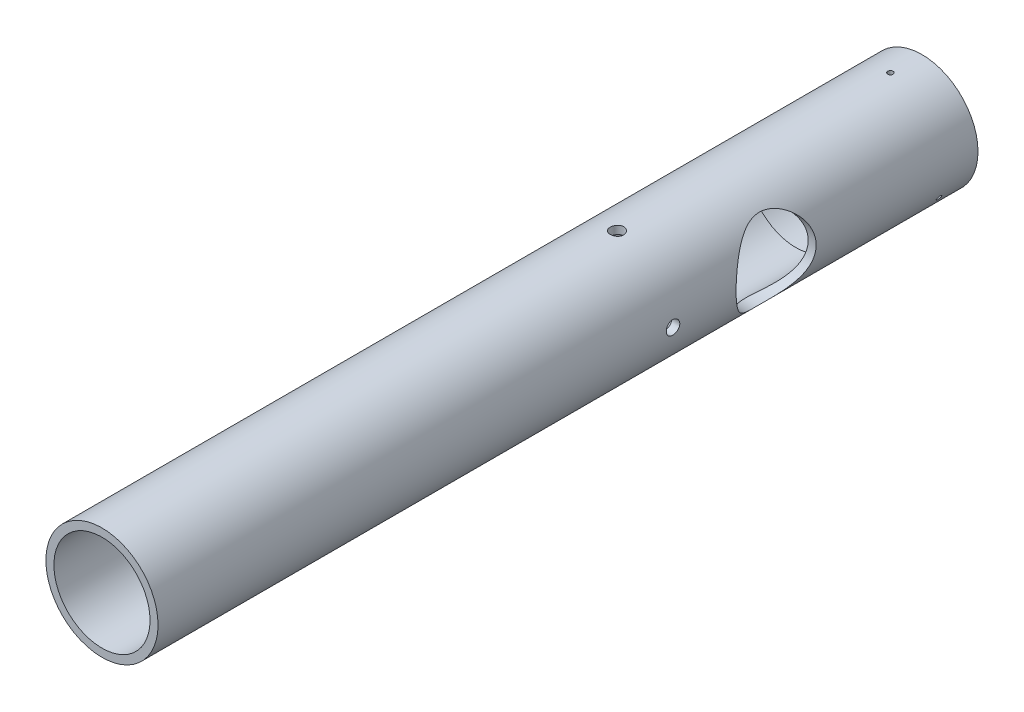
SolidWorks part; units mm, degrees
ref_plane "Front Plane" through (0, 0, 0) normal (0, 0, 1) x (1, 0, 0)
ref_plane "Top Plane" through (0, 0, 0) normal (0, 1, 0) x (1, 0, 0)
ref_plane "Right Plane" through (0, 0, 0) normal (1, 0, 0) x (0, 0, -1)
sketch "Sketch1" plane through (0, 0, 0) normal (0, 0, 1) x (1, 0, 0)
  circle A0 centre (0, 0) radius 44.45
  circle A1 centre (0, 0) radius 38.1
  dimension "D1" = 88.9
  dimension "D2" = 6.35
extrude "Boss-Extrude1" add sketch "Sketch1" along normal blind 500 and the other way blind 150
ref_plane "Plane1" through (0, 44.45, 0) normal (0, 1, 0) x (-1, 0, 0)
ref_plane "Plane2" through (0, 0, -50) normal (0, 0, 1) x (1, 0, 0)
sketch "Sketch6" plane through (0, 0, -50) normal (0, 0, 1) x (1, 0, 0)
  circle A0 centre (0, 0) radius 39.6508
  dimension "D1" = 79.3016
extrude "Cut-Extrude1" cut sketch "Sketch6" against normal through all
sketch "Sketch7" plane through (0, 0, 0) normal (1, 0, 0) x (0, 0, -1)
  line L0 (-500, 44.45) -> (-500, -44.45) construction
  circle A0 centre (-10, 0) radius 31.75
  dimension "D1" = 63.5
  dimension "D2" = 490
extrude "Cut-Extrude2" cut sketch "Sketch7" against normal up to surface and the other way up to surface
ref_plane "Plane3" through (0, 44.45, 0) normal (0, 1, 0) x (-1, 0, 0)
hole_wizard "M5x0.8 Tapped Hole1" positions "Sketch9" profile "Sketch8" tap size "M5x0.8" standard "Ansi Metric"
sketch "Sketch9" plane through (0, 44.45, 0) normal (0, 1, 0) x (-1, 0, 0)
  line L0 (-44.45, -150) -> (44.45, -150) construction
  point P1 (0, -125)
  dimension "D1" = 25
sketch "Sketch8" plane through (0, 44.45, -125) normal (1, 0, 0) x (0, 0, 1)
  line L0 (0, 0) -> (0, 88.9)
  line L1 (0, 88.9) -> (2.1, 88.9)
  line L2 (2.1, 88.9) -> (2.1, 0)
  line L5 (2.1, 0) -> (0, 0)
  line L11 (0, -6.35) -> (0, 107.95) construction
  dimension "Thru Tap Drill Dia." = 4.2
  dimension "Thru Tap Drill Depth" = 88.9
pattern_circular "CirPattern2" count 3 over 360 about axis through (0, 0, -150) along (0, 0, 1) of "M5x0.8 Tapped Hole1"
hole_wizard "1/2-13 Tapped Hole1" positions "Sketch11" profile "Sketch10" tap size "1/2-13" standard "Ansi Inch"
sketch "Sketch11" plane through (0, 44.45, 0) normal (0, 1, 0) x (-1, 0, 0)
  point P1 (0, 91.75)
  dimension "D1" = 50
sketch "Sketch10" plane through (0, 44.45, 91.75) normal (1, 0, 0) x (0, 0, 1)
  line L0 (0, 0) -> (0, 82.551)
  line L1 (0, 82.551) -> (5.3581, 82.551)
  line L2 (5.3581, 82.551) -> (5.3581, 0)
  line L5 (5.3581, 0) -> (0, 0)
  line L11 (0, -6.35) -> (0, 107.95) construction
  dimension "Thru Tap Drill Dia." = 10.7163
  dimension "Thru Tap Drill Depth" = 82.551
pattern_circular "CirPattern3" count 4 over 360 about axis through (0, 0, -150) along (0, 0, 1) of "1/2-13 Tapped Hole1"
chamfer "Chamfer1" distance 1 angle 45 1 edges at (39.6508, 0, -150)
